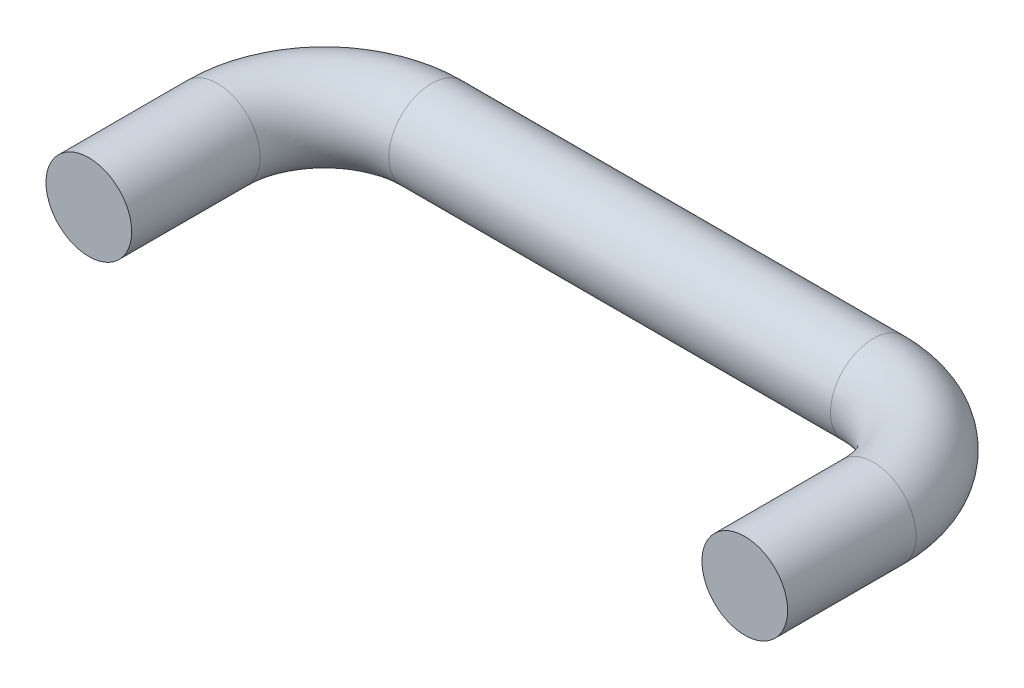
SolidWorks part; units mm, degrees
ref_plane "Front Plane" through (0, 0, 0) normal (0, 0, 1) x (1, 0, 0)
ref_plane "Top Plane" through (0, 0, 0) normal (0, 1, 0) x (1, 0, 0)
ref_plane "Right Plane" through (0, 0, 0) normal (1, 0, 0) x (0, 0, -1)
sketch "Sketch1" plane through (0, 0, 0) normal (0, 0, 1) x (1, 0, 0)
  line L0 (1.8161, 0) -> (-1.8161, 0) construction
  line L1 (3.8895, 0) -> (-3.8895, 0) construction
  circle A1 centre (3.8895, 0) radius 0.508
  circle A2 centre (-3.8895, 0) radius 0.508
  dimension "D1" = 7.779
  dimension "D2" = 1.016
extrude "Boss-Extrude1" add sketch "Sketch1" along normal blind 1.524
sketch "Sketch2" plane through (0, 0, 0) normal (0, 0, -1) x (-1, 0, 0)
  line L0 (-2.6195, 1.8783) -> (-2.6195, -3.0822) construction
  circle A1 centre (-3.8895, 0) radius 0.508
  circle A2 centre (-3.8895, 0) radius 0.508
  dimension "D2" = 1.27
  dimension "D1" = 0
revolve "Revolve1" add sketch "Sketch2" angle 90 about L0
sketch "Sketch3" plane through (0, 0, 0) normal (0, 0, -1) x (-1, 0, 0)
  line L0 (2.6195, 2.0868) -> (2.6195, -1.6919) construction
  circle A1 centre (3.8895, 0) radius 0.508
  circle A2 centre (3.8895, 0) radius 0.508
  dimension "D2" = 1.27
  dimension "D1" = 0
revolve "Revolve2" add sketch "Sketch3" angle 90 about L0
sketch "Sketch4" plane through (2.6195, 0, 0) normal (-1, 0, 0) x (0, 0, 1)
  circle A1 centre (-1.27, 0) radius 0.508
  circle A2 centre (-1.27, 0) radius 0.508
  dimension "D1" = 0
extrude "Boss-Extrude2" add sketch "Sketch4" along normal up to next
